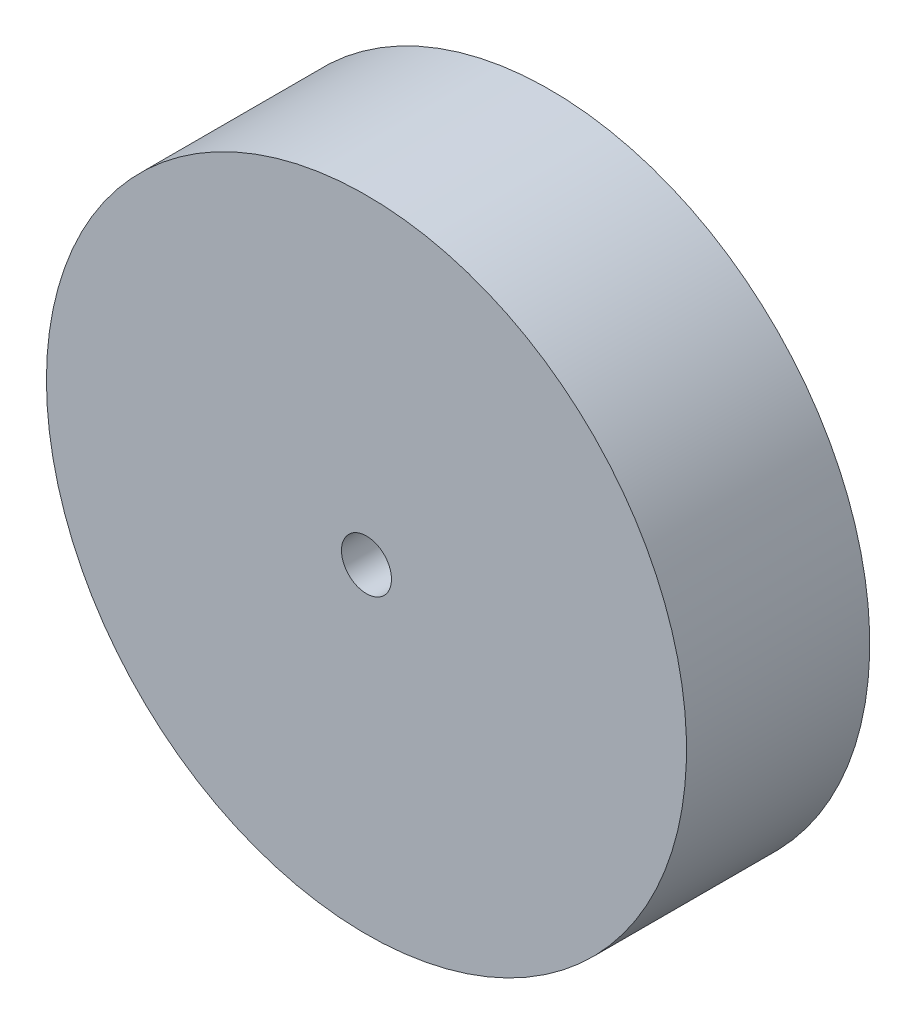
SolidWorks part; units mm, degrees
ref_plane "Front Plane" through (0, 0, 0) normal (0, 0, 1) x (1, 0, 0)
ref_plane "Top Plane" through (0, 0, 0) normal (0, 1, 0) x (1, 0, 0)
ref_plane "Right Plane" through (0, 0, 0) normal (1, 0, 0) x (0, 0, -1)
sketch "Sketch1" plane through (0, 0, 0) normal (0, 0, 1) x (1, 0, 0)
  circle A0 centre (0, 0) radius 50.8
extrude "Extrude1" add sketch "Sketch1" along normal blind 29.083
sketch "Sketch2" plane through (0, 0, 0) normal (0, 0, -1) x (-1, 0, 0)
  circle A0 centre (0, 0) radius 3.9688
extrude "Extrude2" cut sketch "Sketch2" against normal blind 29.083
